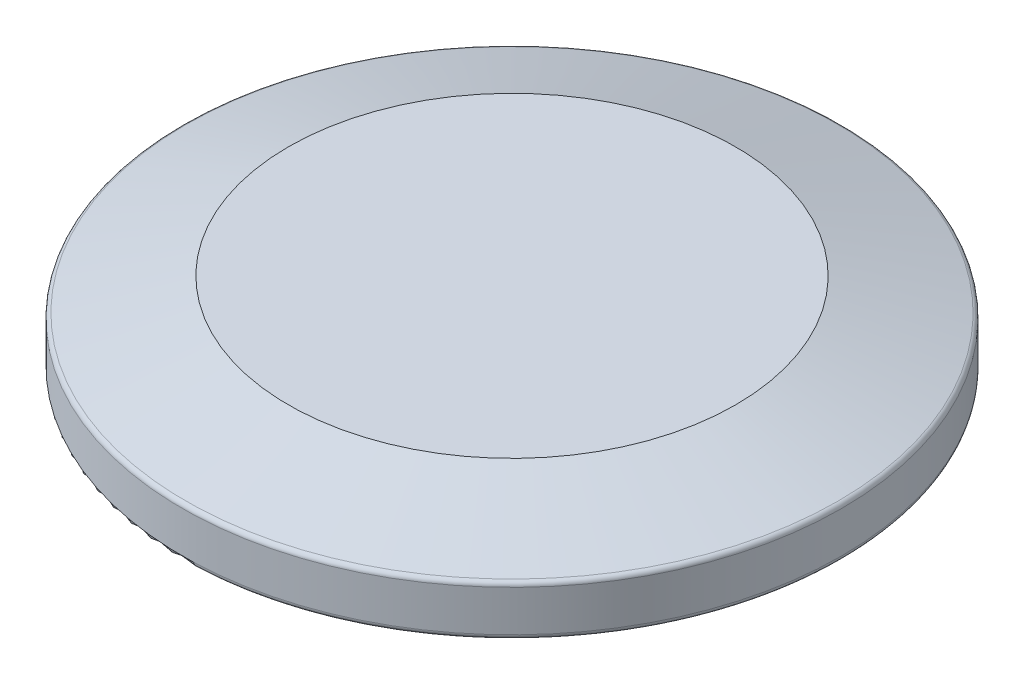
SolidWorks part; units mm, degrees
ref_plane "前视基准面" through (0, 0, 0) normal (0, 0, 1) x (1, 0, 0)
ref_plane "上视基准面" through (0, 0, 0) normal (0, 1, 0) x (1, 0, 0)
ref_plane "右视基准面" through (0, 0, 0) normal (1, 0, 0) x (0, 0, -1)
other "Configuration Table"
sketch "草图1" plane through (0, 0, 0) normal (0, 0, 1) x (1, 0, 0)
  line L0 (0, 0) -> (-10, 0)
  line L1 (-10, 0) -> (-13.2, 0)
  line L2 (-13.2, 0) -> (-19.9, 0)
  line L3 (-19.9, 0) -> (-19.9, 3)
  line L4 (-19.9, 3) -> (-13.5, 5)
  line L5 (-13.5, 5) -> (0, 5)
  line L6 (0, 5) -> (0, 0)
  line L7 (-13.2, 0) -> (-13.2, 2.5)
  line L8 (-13.2, 2.5) -> (-10, 2.5)
  line L9 (-10, 2.5) -> (-10, 0)
  dimension "D1" = 10
  dimension "D2" = 3.2
  dimension "D3" = 6.7
  dimension "D4" = 3
  dimension "D5" = 2.5
  dimension "D6" = 5
  dimension "D7" = 13.5
revolve "旋转1" add sketch "草图1" angle 360 about L6
fillet "圆角1" radius 0.3 1 edges at (-19.9, 3, 0)
fillet "圆角2" radius 0.3 1 edges at (-19.9, 0, 0)
fillet "圆角3" radius 0.3 1 edges at (-13.2, 0, 0)
